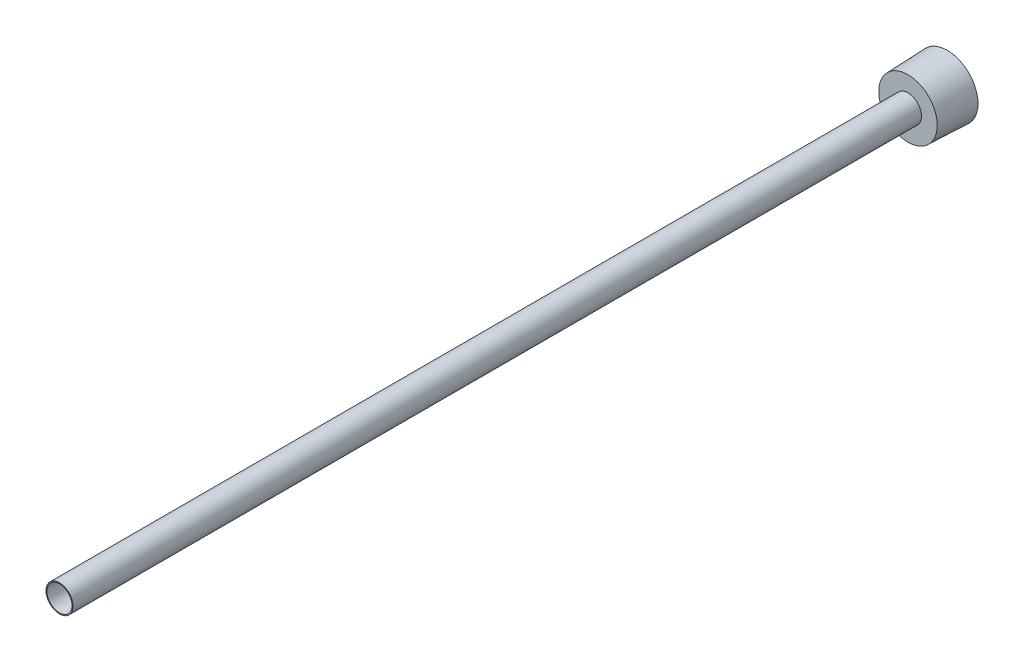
SolidWorks part; units mm, degrees
ref_plane "Front Plane" through (0, 0, 0) normal (0, 0, 1) x (1, 0, 0)
ref_plane "Top Plane" through (0, 0, 0) normal (0, 1, 0) x (1, 0, 0)
ref_plane "Right Plane" through (0, 0, 0) normal (1, 0, 0) x (0, 0, -1)
sketch "Sketch1" plane through (0, 0, 0) normal (1, 0, 0) x (0, 0, -1)
  line L0 (-223.2122, 0) -> (49776.7878, 0) construction
  line L6 (0, 10.541) -> (-13.4874, 10.049)
  line L7 (0, 0) -> (0, 10.541)
  line L8 (-13.4874, 10.049) -> (-13.4874, 4.6355)
  line L9 (-13.4874, 4.6355) -> (-304.8, 4.6355)
  line L10 (-304.8, 4.6355) -> (-304.8, 0)
  line L11 (0, 0) -> (-304.8, 0)
  dimension "D1" = 2.089
  dimension "D2" = 13.4874
  dimension "D3" = 21.082
  dimension "D4" = 9.271
  dimension "D5" = 304.8
revolve "Revolve1" add sketch "Sketch1" angle 360 about L0
sketch "Sketch2" plane through (0, 0, 304.8) normal (0, 0, 1) x (1, 0, 0)
  circle A0 centre (0, 0) radius 4.318
  dimension "D1" = 8.636
extrude "Cut-Extrude1" cut sketch "Sketch2" against normal through all
sketch "Sketch3" plane through (0, 0, 0) normal (0, 0, -1) x (-1, 0, 0)
  line L0 (0, 11.5951) -> (0, -11.5951) construction
  line L1 (0, -7.3323) -> (6.35, -3.6662)
  line L2 (6.35, -3.6662) -> (6.35, 3.6662)
  line L3 (6.35, 3.6662) -> (0, 7.3323)
  line L4 (0, 7.3323) -> (-6.35, 3.6662)
  line L5 (-6.35, 3.6662) -> (-6.35, -3.6662)
  line L6 (-6.35, -3.6662) -> (0, -7.3323)
  circle A0 centre (0, 0) radius 6.35 construction
  dimension "D1" = 12.7
extrude "Cut-Extrude2" cut sketch "Sketch3" against normal blind 9.525
